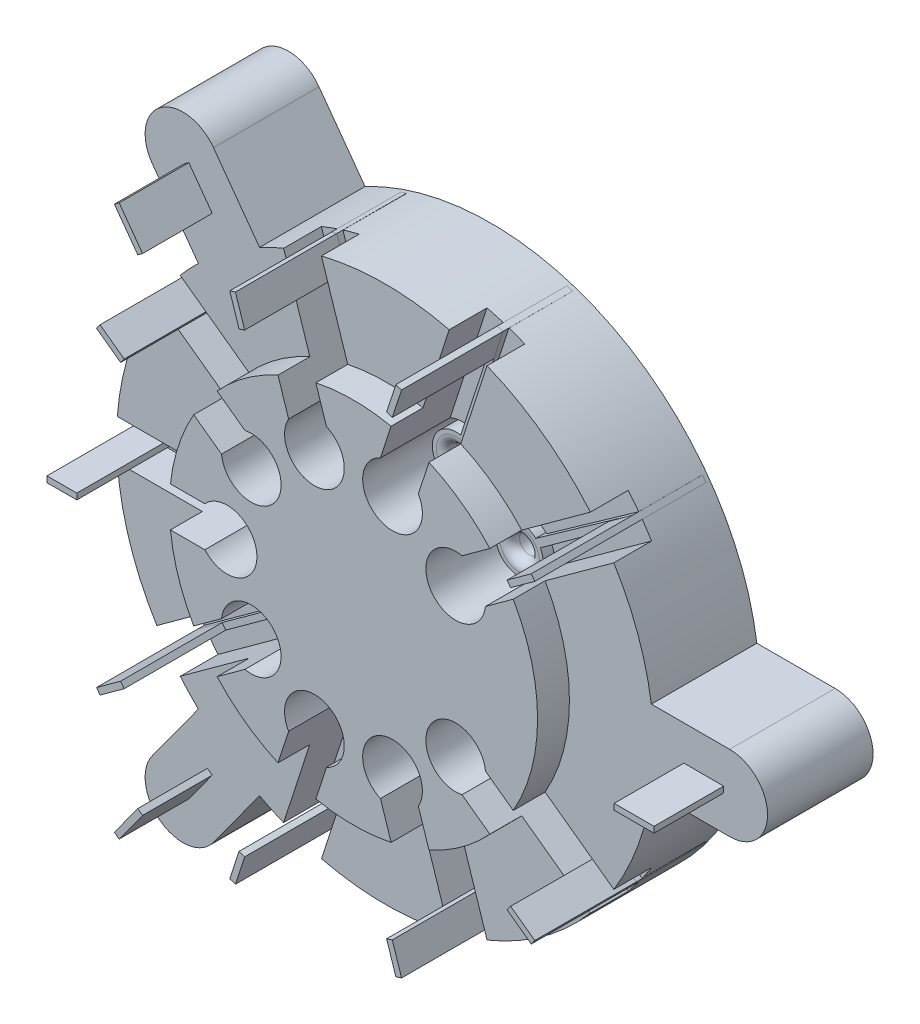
SolidWorks part; units mm, degrees
ref_plane "Front" through (0, 0, 0) normal (0, 0, 1) x (1, 0, 0)
ref_plane "Top" through (0, 0, 0) normal (0, 1, 0) x (1, 0, 0)
ref_plane "Right" through (0, 0, 0) normal (1, 0, 0) x (0, 0, -1)
sketch "Sketch1" plane through (0, 0, 0) normal (0, 0, 1) x (1, 0, 0)
  line L0 (-11.7058, 12.8792) -> (-9.3933, 9.6962)
  line L1 (-8.6316, 15.1128) -> (-6.319, 11.9298)
  line L2 (13.3656, 1.9) -> (17.3, 1.9)
  line L3 (13.3656, -1.9) -> (17.309, -1.9)
  line L4 (-9.3933, -9.6962) -> (-11.7058, -12.8792)
  line L5 (-6.319, -11.9298) -> (-8.6316, -15.1128)
  arc A0 (-6.319, 11.9298) -> (13.3656, 1.9) centre (0, 0) cw
  arc A2 (17.3, 1.9) -> (17.309, -1.9) centre (17.3045, 0) cw
  arc A3 (-11.7058, -12.8792) -> (-8.6316, -15.1128) centre (-10.1687, -13.996) ccw
  arc A4 (-11.7058, 12.8792) -> (-8.6316, 15.1128) centre (-10.1687, 13.996) cw
  arc A5 (13.3656, -1.9) -> (-6.319, -11.9298) centre (0, 0) cw
  arc A6 (-9.3933, -9.6962) -> (-9.3933, 9.6962) centre (0, 0) cw
extrude "Boss-Extrude1" add sketch "Sketch1" along normal blind 5.3
sketch "Sketch2" plane through (0, 0, 5.3) normal (0, 0, 1) x (1, 0, 0)
  circle A0 centre (0, 0) radius 9.25
extrude "Boss-Extrude2" add sketch "Sketch2" along normal blind 1.6
sketch "Sketch5" plane through (0, 0, 0) normal (0, 0, -1) x (-1, 0, 0)
  circle A0 centre (0, 0) radius 9
extrude "Boss-Extrude4" add sketch "Sketch5" along normal blind 1.6
sketch "Sketch3" plane through (0, 0, 6.9) normal (0, 0, 1) x (1, 0, 0)
  circle A1 centre (5.1373, 3.7324) radius 1.5
  circle A2 centre (1.9623, 6.0392) radius 1.5
  circle A3 centre (-1.9623, 6.0392) radius 1.5
  circle A4 centre (-5.1373, 3.7324) radius 1.5
  circle A5 centre (-6.35, 0) radius 1.5
  circle A6 centre (-5.1373, -3.7324) radius 1.5
  circle A7 centre (-1.9623, -6.0392) radius 1.5
  circle A8 centre (1.9623, -6.0392) radius 1.5
  circle A9 centre (5.1373, -3.7324) radius 1.5
extrude "Cut-Extrude1" cut sketch "Sketch3" against normal up to surface (8.5 mm away)
sketch "Sketch7" plane through (0, 0, 6.9) normal (0, 0, 1) x (1, 0, 0)
  line L0 (11.5095, 7.1261) -> (10.3339, 8.7441)
  line L1 (3.2207, 13.1483) -> (5.1228, 12.5302)
  line L2 (-5.1228, 12.5302) -> (-3.2207, 13.1483)
  line L3 (-10.3339, 8.7441) -> (-11.5095, 7.1261)
  line L4 (-13.5, 1) -> (-13.5, -1)
  line L5 (-11.5095, -7.1261) -> (-10.3339, -8.7441)
  line L6 (-5.1228, -12.5302) -> (-3.2207, -13.1483)
  line L9 (11.5095, -7.1261) -> (10.3339, -8.7441)
  line L10 (3.2207, -13.1483) -> (5.1228, -12.5302)
  line L11 (10.3339, -8.7441) -> (5.3989, -5.1586)
  line L12 (5.3989, -5.1586) -> (6.5745, -3.5406)
  line L13 (6.5745, -3.5406) -> (11.5095, -7.1261)
  line L14 (-3.2207, -13.1483) -> (-1.3357, -7.3468)
  line L15 (5.1228, -12.5302) -> (3.2378, -6.7288)
  line L16 (3.2207, -13.1483) -> (1.3357, -7.3468)
  line L17 (1.3357, -7.3468) -> (3.2378, -6.7288)
  line L18 (-1.3357, -7.3468) -> (-3.2378, -6.7288)
  line L19 (-3.2378, -6.7288) -> (-5.1228, -12.5302)
  line L20 (-10.3339, -8.7441) -> (-5.3989, -5.1586)
  line L21 (-11.5095, -7.1261) -> (-6.5745, -3.5406)
  line L22 (-6.5745, -3.5406) -> (-5.3989, -5.1586)
  line L23 (-13.5, 1) -> (-7.4, 1)
  line L24 (-13.5, -1) -> (-7.4, -1)
  line L25 (-7.4, 1) -> (-7.4, -1)
  line L26 (-10.3339, 8.7441) -> (-5.3989, 5.1586)
  line L27 (-5.3989, 5.1586) -> (-6.5745, 3.5406)
  line L28 (-6.5745, 3.5406) -> (-11.5095, 7.1261)
  line L29 (-5.1228, 12.5302) -> (-3.2378, 6.7288)
  line L30 (-3.2378, 6.7288) -> (-1.3357, 7.3468)
  line L31 (-3.2207, 13.1483) -> (-1.3357, 7.3468)
  line L32 (3.2207, 13.1483) -> (1.3357, 7.3468)
  line L33 (1.3357, 7.3468) -> (3.2378, 6.7288)
  line L34 (3.2378, 6.7288) -> (5.1228, 12.5302)
  line L35 (10.3339, 8.7441) -> (5.3989, 5.1586)
  line L36 (5.3989, 5.1586) -> (6.5745, 3.5406)
  line L37 (6.5745, 3.5406) -> (11.5095, 7.1261)
extrude "Cut-Extrude6" cut sketch "Sketch7" against normal blind 3.5
sketch "Sketch4" plane through (0, 0, 5.3) normal (0, 0, 1) x (1, 0, 0)
  line L0 (-10.1137, 13.6651) -> (-9.871, 13.8415)
  line L1 (-9.871, -13.8415) -> (-10.1137, -13.6651)
  line L2 (-10.8336, -8.0565) -> (-11.0099, -7.8137)
  line L3 (10.8336, 8.0565) -> (11.0099, 7.8137)
  line L4 (4.0291, 12.8856) -> (4.3144, 12.7929)
  line L5 (-4.3144, 12.7929) -> (-4.0291, 12.8856)
  line L6 (-10.8336, 8.0565) -> (-11.0099, 7.8137)
  line L7 (-13.5, 0.15) -> (-13.5, -0.15)
  line L8 (-4.0291, -12.8856) -> (-4.3144, -12.7929)
  line L9 (4.0291, -12.8856) -> (4.3144, -12.7929)
  line L10 (11.0099, -7.8137) -> (10.8336, -8.0565)
  line L12 (15, -0.15) -> (17, -0.15)
  line L13 (15, 0.15) -> (17, 0.15)
  line L14 (15, 0.15) -> (15, -0.15)
  line L15 (17, 0.15) -> (17, -0.15)
  line L17 (-10.1137, -13.6651) -> (-8.9381, -12.0471)
  line L18 (-10.1137, 13.6651) -> (-8.9381, 12.0471)
  line L19 (-9.871, 13.8415) -> (-8.6954, 12.2234)
  line L20 (-8.6954, 12.2234) -> (-8.9381, 12.0471)
  line L21 (-9.871, -13.8415) -> (-8.6954, -12.2234)
  line L22 (-8.9381, -12.0471) -> (-8.6954, -12.2234)
  line L23 (-11.0099, -7.8137) -> (-9.7964, -6.9321)
  line L24 (-10.8336, -8.0565) -> (-9.62, -7.1748)
  line L25 (-9.62, -7.1748) -> (-9.7964, -6.9321)
  line L26 (-4.3144, -12.7929) -> (-3.8509, -11.3663)
  line L27 (-4.0291, -12.8856) -> (-3.5655, -11.459)
  line L28 (-3.5655, -11.459) -> (-3.8509, -11.3663)
  line L29 (4.0291, -12.8856) -> (3.5655, -11.459)
  line L30 (4.3144, -12.7929) -> (3.8509, -11.3663)
  line L31 (3.8509, -11.3663) -> (3.5655, -11.459)
  line L32 (10.8336, -8.0565) -> (9.62, -7.1748)
  line L33 (11.0099, -7.8137) -> (9.7964, -6.9321)
  line L34 (9.7964, -6.9321) -> (9.62, -7.1748)
  line L35 (-13.5, 0.15) -> (-12, 0.15)
  line L36 (-13.5, -0.15) -> (-12, -0.15)
  line L37 (-12, -0.15) -> (-12, 0.15)
  line L38 (-10.8336, 8.0565) -> (-9.62, 7.1748)
  line L39 (-9.62, 7.1748) -> (-9.7964, 6.9321)
  line L40 (-9.7964, 6.9321) -> (-11.0099, 7.8137)
  line L41 (-4.3144, 12.7929) -> (-3.8509, 11.3663)
  line L42 (-3.8509, 11.3663) -> (-3.5655, 11.459)
  line L43 (-3.5655, 11.459) -> (-4.0291, 12.8856)
  line L44 (4.0291, 12.8856) -> (3.5655, 11.459)
  line L45 (3.5655, 11.459) -> (3.8509, 11.3663)
  line L46 (3.8509, 11.3663) -> (4.3144, 12.7929)
  line L47 (10.8336, 8.0565) -> (9.62, 7.1748)
  line L48 (9.62, 7.1748) -> (9.7964, 6.9321)
  line L49 (9.7964, 6.9321) -> (11.0099, 7.8137)
extrude "Boss-Extrude5" add sketch "Sketch4" along normal blind 3.5 and the other way blind 1.6 separate body
sketch "Sketch8" plane through (0, 0, 3.7) normal (0, 0, -1) x (-1, 0, 0)
  line L0 (-10.8336, 8.0565) -> (-5.9586, 4.6073)
  line L1 (-10.8336, 8.0565) -> (-11.0099, 7.8137)
  line L2 (-11.0099, 7.8137) -> (-6.1886, 4.3109)
  line L3 (-4.0291, 12.8856) -> (-4.3144, 12.7929)
  line L4 (-4.3144, 12.7929) -> (-2.4728, 7.1252)
  line L5 (-4.0291, 12.8856) -> (-2.1875, 7.2179)
  line L6 (4.3144, 12.7929) -> (4.0291, 12.8856)
  line L7 (4.0291, 12.8856) -> (2.1875, 7.2179)
  line L8 (4.3144, 12.7929) -> (2.4728, 7.1252)
  line L9 (11.0099, 7.8137) -> (10.8336, 8.0565)
  line L10 (10.8336, 8.0565) -> (6.0123, 4.5536)
  line L11 (11.0099, 7.8137) -> (6.1886, 4.3109)
  line L12 (13.5, -0.15) -> (13.5, 0.15)
  line L13 (13.5, 0.15) -> (7.5406, 0.15)
  line L14 (13.5, -0.15) -> (7.5406, -0.15)
  line L15 (10.8336, -8.0565) -> (11.0099, -7.8137)
  line L16 (11.0099, -7.8137) -> (6.1886, -4.3109)
  line L17 (10.8336, -8.0565) -> (6.0123, -4.5536)
  line L18 (4.0291, -12.8856) -> (4.3144, -12.7929)
  line L19 (4.3144, -12.7929) -> (2.4728, -7.1252)
  line L20 (4.0291, -12.8856) -> (2.1875, -7.2179)
  line L21 (-4.0291, -12.8856) -> (-4.3144, -12.7929)
  line L22 (-4.3144, -12.7929) -> (-2.4728, -7.1252)
  line L23 (-4.0291, -12.8856) -> (-2.1875, -7.2179)
  line L24 (-10.8336, -8.0565) -> (-11.0099, -7.8137)
  line L25 (-10.8336, -8.0565) -> (-6.0123, -4.5536)
  line L26 (-11.0099, -7.8137) -> (-6.1886, -4.3109)
  circle A0 centre (-5.1373, 3.7324) radius 0.5
  circle A1 centre (-1.9623, 6.0392) radius 0.5
  arc A2 (-6.1886, 4.3109) -> (-5.9586, 4.6073) centre (-5.1373, 3.7324) ccw
  arc A3 (-2.1875, 7.2179) -> (-2.4728, 7.1252) centre (-1.9623, 6.0392) cw
  circle A4 centre (1.9623, 6.0392) radius 0.5
  arc A5 (2.4728, 7.1252) -> (2.1875, 7.2179) centre (1.9623, 6.0392) cw
  circle A6 centre (5.1373, 3.7324) radius 0.5
  arc A7 (6.1886, 4.3109) -> (6.0123, 4.5536) centre (5.1373, 3.7324) cw
  circle A8 centre (6.35, 0) radius 0.5
  arc A9 (7.5406, -0.15) -> (7.5406, 0.15) centre (6.35, 0) cw
  circle A10 centre (5.1373, -3.7324) radius 0.5
  arc A11 (6.0123, -4.5536) -> (6.1886, -4.3109) centre (5.1373, -3.7324) cw
  circle A12 centre (1.9623, -6.0392) radius 0.5
  arc A13 (2.1875, -7.2179) -> (2.4728, -7.1252) centre (1.9623, -6.0392) cw
  circle A14 centre (-1.9623, -6.0392) radius 0.5
  arc A15 (-2.4728, -7.1252) -> (-2.1875, -7.2179) centre (-1.9623, -6.0392) cw
  circle A16 centre (-5.1373, -3.7324) radius 0.5
  arc A17 (-6.1886, -4.3109) -> (-6.0123, -4.5536) centre (-5.1373, -3.7324) cw
extrude "Boss-Extrude6" add sketch "Sketch8" along normal blind 3.5
fillet "Fillet1" radius 0.5 1 edges at (4.6373, 3.7324, 3.7)
fillet "Fillet2" radius 0.5 1 edges at (1.4623, 6.0392, 3.7)
fillet "Fillet3" radius 0.5 1 edges at (-2.4623, 6.0392, 3.7)
fillet "Fillet4" radius 0.5 1 edges at (-5.6373, 3.7324, 3.7)
fillet "Fillet5" radius 0.5 1 edges at (-6.85, 0, 3.7)
fillet "Fillet6" radius 0.5 1 edges at (-5.6373, -3.7324, 3.7)
fillet "Fillet7" radius 0.5 1 edges at (-2.4623, -6.0392, 3.7)
fillet "Fillet8" radius 0.5 1 edges at (1.4623, -6.0392, 3.7)
fillet "Fillet9" radius 0.5 1 edges at (4.6373, -3.7324, 3.7)
